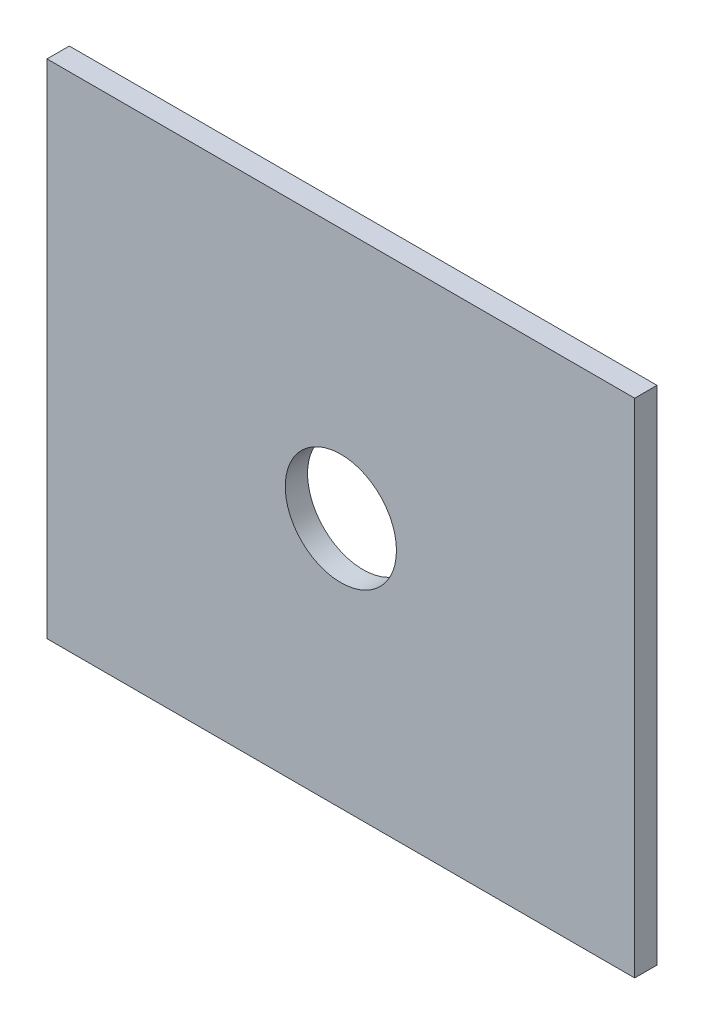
SolidWorks part; units mm, degrees
ref_plane "Plan de face" through (0, 0, 0) normal (0, 0, 1) x (1, 0, 0)
ref_plane "Plan de dessus" through (0, 0, 0) normal (0, 1, 0) x (1, 0, 0)
ref_plane "Plan de droite" through (0, 0, 0) normal (1, 0, 0) x (0, 0, -1)
sketch "Esquisse1" plane through (0, 0, 0) normal (0, 0, 1) x (1, 0, 0)
  line L1 (-75.1548, 62.5606) -> (82.8452, 62.5606)
  line L2 (-75.1548, 62.5606) -> (-75.1548, -72.4394)
  line L3 (-75.1548, -72.4394) -> (82.8452, -72.4394)
  line L4 (82.8452, 62.5606) -> (82.8452, -72.4394)
  circle A0 centre (3.8452, -4.9394) radius 14.95
  dimension "D5" = 29.9
  dimension "D1" = 158
  dimension "D2" = 135
  dimension "D3" = 79
  dimension "D4" = 67.5
extrude "Boss.-Extru.1" add sketch "Esquisse1" along normal blind 6
